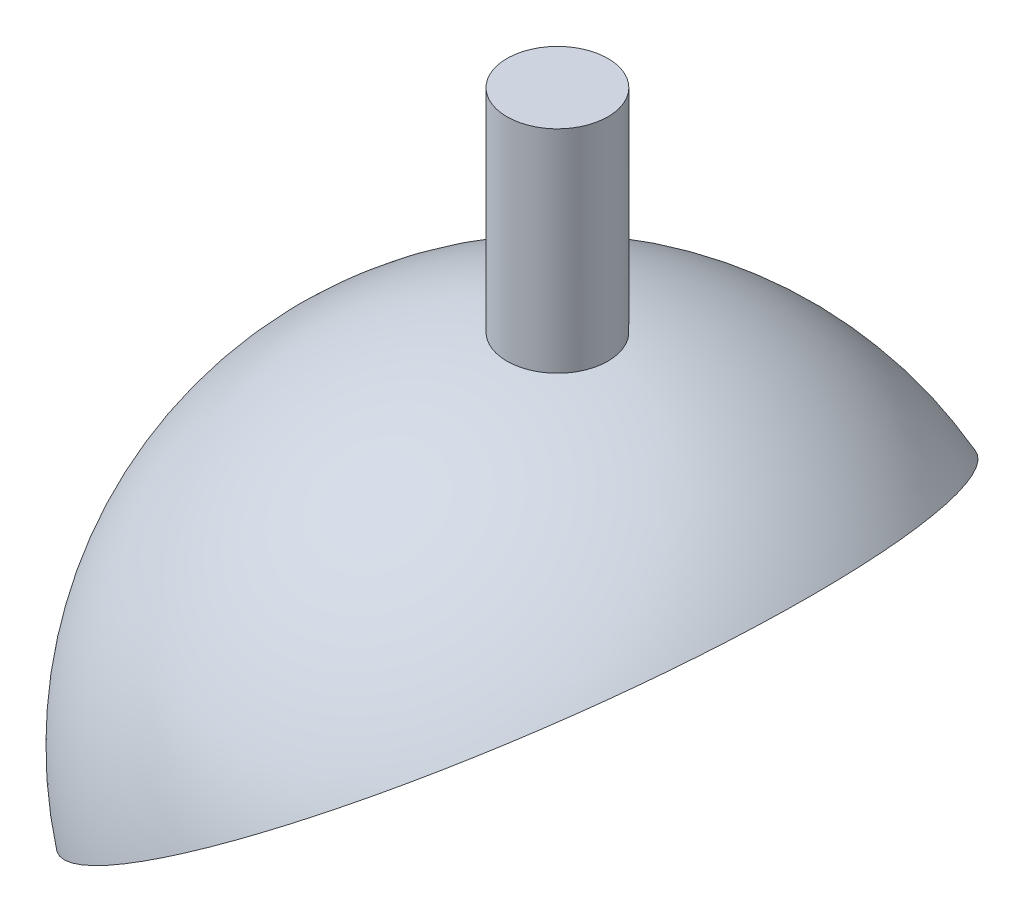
SolidWorks part; units mm, degrees
ref_plane "Płaszczyzna przednia" through (0, 0, 0) normal (0, 0, 1) x (1, 0, 0)
ref_plane "Płaszczyzna górna" through (0, 0, 0) normal (0, 1, 0) x (1, 0, 0)
ref_plane "Płaszczyzna prawa" through (0, 0, 0) normal (1, 0, 0) x (0, 0, -1)
sketch "Szkic1" plane through (0, 0, 0) normal (0, 0, 1) x (1, 0, 0)
  line L0 (35.1495, 35.56) -> (-46.2741, -18.9395)
  line L1 (-27.8116, 41.5513) -> (0, 0) construction
  line L2 (0, 0) -> (43.6504, -65.2148) construction
  line L3 (0, 50) -> (0, -60.8615) construction
  circle A0 centre (0, 0) radius 50
  point P8 (-27.8116, 41.5513)
  dimension "D1" = 100
  dimension "D2" = 40
  dimension "D3" = 38
sketch "Szkic3" plane through (0, 0, 0) normal (0, 0, 1) x (1, 0, 0)
  line L0 (-27.8116, 41.5513) -> (0, 0) construction
  line L3 (-27.8116, 41.5513) -> (0, 0) construction
  line L4 (35.1495, 35.56) -> (29.1921, 31.5725)
  line L5 (35.1495, 35.56) -> (-46.2741, -18.9395) construction
  line L6 (29.1921, 31.5725) -> (22.6945, 41.28)
  line L7 (22.6945, 41.28) -> (-10.0413, 41.8111)
  line L8 (-10.0413, 41.8111) -> (-23.918, 35.7341)
  line L9 (-27.8116, 41.5513) -> (-23.918, 35.7341)
  circle A0 centre (0, 0) radius 50 construction
  arc A1 (35.1495, 35.56) -> (-27.8116, 41.5513) centre (0, 0) ccw
revolve "Obrót1" add sketch "Szkic3" angle 360 about L3
sketch "Szkic4" plane through (0, 0, 0) normal (0, 0, 1) x (1, 0, 0)
  line L0 (0, 49.305) -> (6.9806, 49.305)
  line L1 (0, 50) -> (0, -60.8615) construction
  line L2 (6.9806, 49.305) -> (6.9806, 78.7656)
  line L3 (6.9806, 78.7656) -> (0, 78.7656)
  line L4 (0, 78.7656) -> (0, 49.305)
revolve "Obrót2" add sketch "Szkic4" angle 360 about L4
